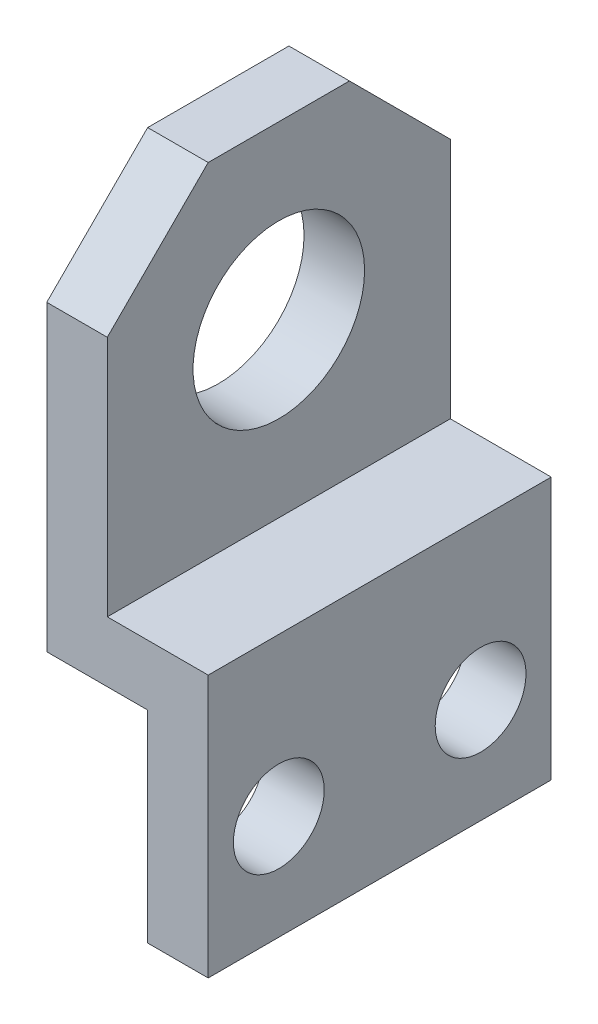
SolidWorks part; units mm, degrees
ref_plane "Plan de face" through (0, 0, 0) normal (0, 0, 1) x (1, 0, 0)
ref_plane "Plan de dessus" through (0, 0, 0) normal (0, 1, 0) x (1, 0, 0)
ref_plane "Plan de droite" through (0, 0, 0) normal (1, 0, 0) x (0, 0, -1)
sketch "Esquisse1" plane through (0, 0, 0) normal (0, 0, 1) x (1, 0, 0)
  line L0 (0, 0) -> (0, 20)
  line L1 (0, 0) -> (5, 0)
  line L2 (5, 0) -> (5, -10)
  dimension "D1" = 5
  dimension "D2" = 20
  dimension "D3" = 10
extrude "Extru.-Mince1" add sketch "Esquisse1" along normal mid plane 17 thin
chamfer "Chanfrein1" distance 5 angle 45 2 edges at (1.5, 20, -8.5) (1.5, 20, 8.5)
sketch "Esquisse2" plane through (3, 0, 0) normal (1, 0, 0) x (0, 0, -1)
  line L0 (-3.5, 20) -> (3.5, 20) construction
  circle A0 centre (0, 11.5) radius 4.25
  dimension "D2" = 8.5
  dimension "D1" = 8.5
extrude "Enlèv. mat.-Extru.1" cut sketch "Esquisse2" against normal blind 10
sketch "Esquisse3" plane through (5, 0, 0) normal (-1, 0, 0) x (0, 0, 1)
  line L0 (-8.5, 0) -> (-8.5, -10) construction
  line L1 (8.5, 0) -> (8.5, -10) construction
  circle A0 centre (-5, -4.8088) radius 2.25
  circle A1 centre (5, -4.8088) radius 2.25
  dimension "D2" = 4.5
  dimension "D1" = 3.5
  dimension "D3" = 3.5
extrude "Enlèv. mat.-Extru.2" cut sketch "Esquisse3" against normal blind 10
